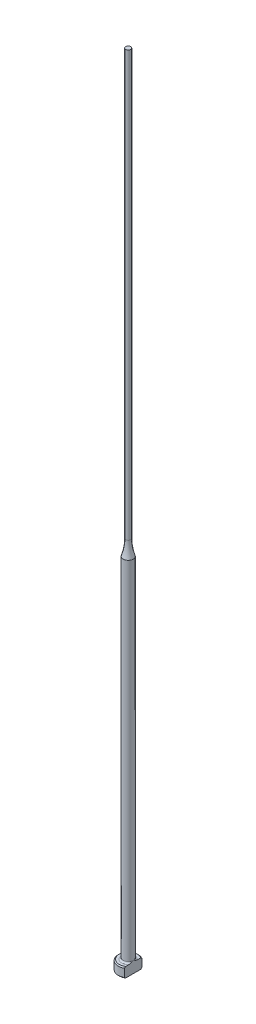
SolidWorks part; units mm, degrees
ref_plane "Front Plane" through (0, 0, 0) normal (0, 0, 1) x (1, 0, 0)
ref_plane "Top Plane" through (0, 0, 0) normal (0, 1, 0) x (1, 0, 0)
ref_plane "Right Plane" through (0, 0, 0) normal (1, 0, 0) x (0, 0, -1)
sketch "Sketch1" plane through (0, 0, 0) normal (0, 0, 1) x (1, 0, 0)
  line L0 (0, 259.9588) -> (0, -15.1925) construction
  line L1 (0, 0) -> (-2, 0)
  line L2 (-2, 0) -> (-2, 2)
  line L3 (-2, 2) -> (-1, 2)
  line L4 (-0.5, 75) -> (-0.5, 160)
  line L5 (-0.5, 160) -> (0, 160)
  line L6 (0, 160) -> (0, 0)
  line L7 (-1, 2) -> (-1, 71.8775)
  arc A0 (-1, 71.8775) -> (-0.5, 75) centre (-10.5, 75) ccw
  point P13 (-1, 0)
  dimension "D1" = 10
  dimension "L" = 160
  dimension "H" = 4
  dimension "T" = 2
  dimension "D" = 1
  dimension "B" = 2
  dimension "S" = 75
revolve "Revolve1" add sketch "Sketch1" angle 360 about L0
chamfer "Chamfer1" distance 0.2 angle 45 2 edges at (0, 2, 2) (0, 0, 2)
fillet "Fillet1" radius 0.3 1 edges at (0, 2, 1)
sketch "Sketch2" plane through (0, 0, 0) normal (0, 1, 0) x (1, 0, 0)
  line L0 (1, 1.7321) -> (1, -1.7321)
  circle A0 centre (0, 0) radius 2 construction
  arc A1 (1, -1.7321) -> (1, 1.7321) centre (0, 0) ccw
  circle A2 centre (0, 0) radius 1 construction
extrude "KEY" cut sketch "Sketch2" along normal through all
